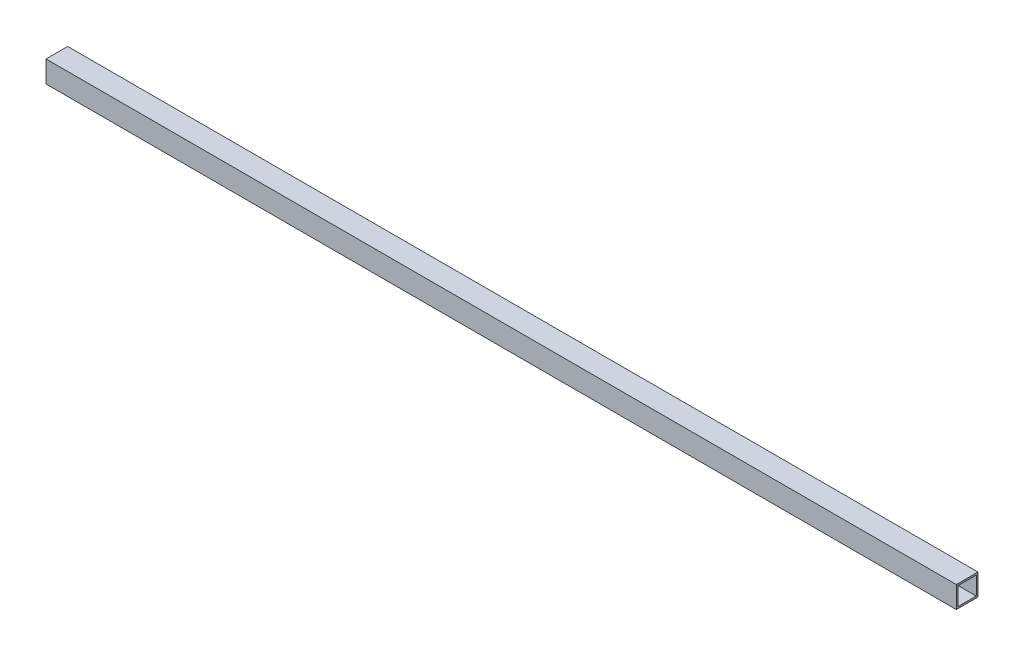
SolidWorks part; units mm, degrees
ref_plane "Plan de face" through (0, 0, 0) normal (0, 0, 1) x (1, 0, 0)
ref_plane "Plan de dessus" through (0, 0, 0) normal (0, 1, 0) x (1, 0, 0)
ref_plane "Plan de droite" through (0, 0, 0) normal (1, 0, 0) x (0, 0, -1)
sketch "Esquisse1" plane through (0, 0, 0) normal (0, 0, 1) x (1, 0, 0)
  line L0 (0, 0) -> (0, 25)
  line L1 (0, 25) -> (1050, 25)
  line L2 (1050, 25) -> (1050, 0)
  line L3 (1050, 0) -> (0, 0)
  dimension "D1" = 1050
  dimension "D3" = 25
extrude "Boss.-Extru.1" add sketch "Esquisse1" along normal blind 25
ref_plane "HAUT" through (0, 0, 0) normal (-1, 0, 0) x (0, 0, 1)
sketch "Esquisse2" plane through (0, 0, 0) normal (-1, 0, 0) x (0, 0, 1)
  line L0 (0, 25) -> (0, 0) construction
  line L1 (2, 2) -> (23, 2)
  line L2 (2, 2) -> (2, 23)
  line L3 (2, 23) -> (23, 23)
  line L4 (23, 2) -> (23, 23)
  line L5 (25, 25) -> (25, 0) construction
  line L6 (25, 25) -> (0, 25) construction
  line L7 (25, 0) -> (0, 0) construction
  dimension "D1" = 2
  dimension "D2" = 2
  dimension "D3" = 2
  dimension "D4" = 2
extrude "Enlèv. mat.-Extru.1" cut sketch "Esquisse2" along direction (1, 0, 0) on the side against the normal through all
